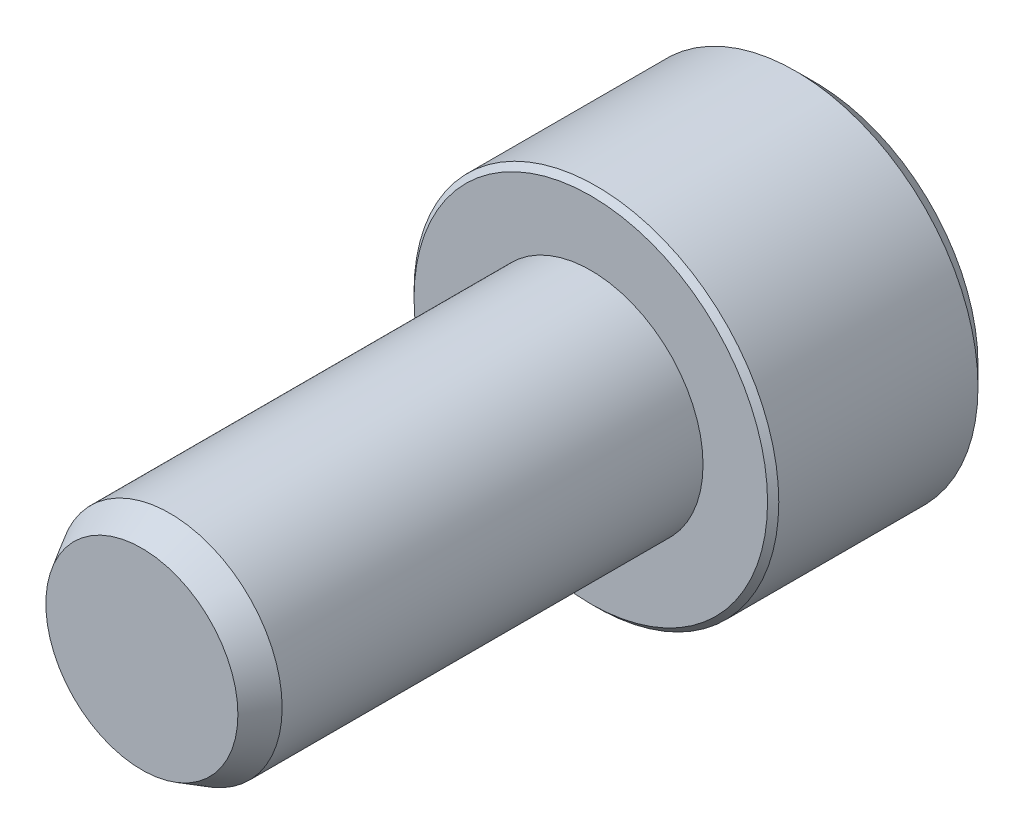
SolidWorks part; units mm, degrees
ref_plane "Plan1" through (0, 0, 0) normal (0, 0, 1) x (1, 0, 0)
ref_plane "Plan2" through (0, 0, 0) normal (0, 1, 0) x (1, 0, 0)
ref_plane "Plan3" through (0, 0, 0) normal (1, 0, 0) x (0, 0, -1)
sketch "Esquisse1" plane through (0, 0, 0) normal (0, 0, 1) x (1, 0, 0)
  circle A0 centre (0, 0) radius 4
  dimension "D1" = 8
extrude "Base-Extrusion" add sketch "Esquisse1" along normal blind 16
sketch "Esquisse2" plane through (0, 0, 0) normal (0, 0, 1) x (1, 0, 0)
  circle A0 centre (0, 0) radius 6.5
  dimension "D1" = 13
extrude "Boss.-Extru.1" add sketch "Esquisse2" against normal blind 8
sketch "Esquisse3" plane through (0, 0, -8) normal (0, 0, -1) x (-1, 0, 0)
  line L1 (3.4641, 0) -> (1.7321, 3)
  line L2 (1.7321, 3) -> (-1.7321, 3)
  line L3 (-1.7321, 3) -> (-3.4641, 0)
  line L4 (-3.4641, 0) -> (-1.7321, -3)
  line L5 (-1.7321, -3) -> (1.7321, -3)
  line L6 (1.7321, -3) -> (3.4641, 0)
  circle A0 centre (0, 0) radius 3 construction
  dimension "D1" = 6
extrude "Enlèv. mat.-Extru.1" cut sketch "Esquisse3" against normal blind 4.5
chamfer "Chanfrein1" distance 0.7 angle 45 1 edges at (6.5, 0, -8)
chamfer "Chanfrein2" distance 1 angle 30 1 edges at (4, 0, 16)
chamfer "Chanfrein3" distance 0.2 angle 45 1 edges at (6.5, 0, 0)
